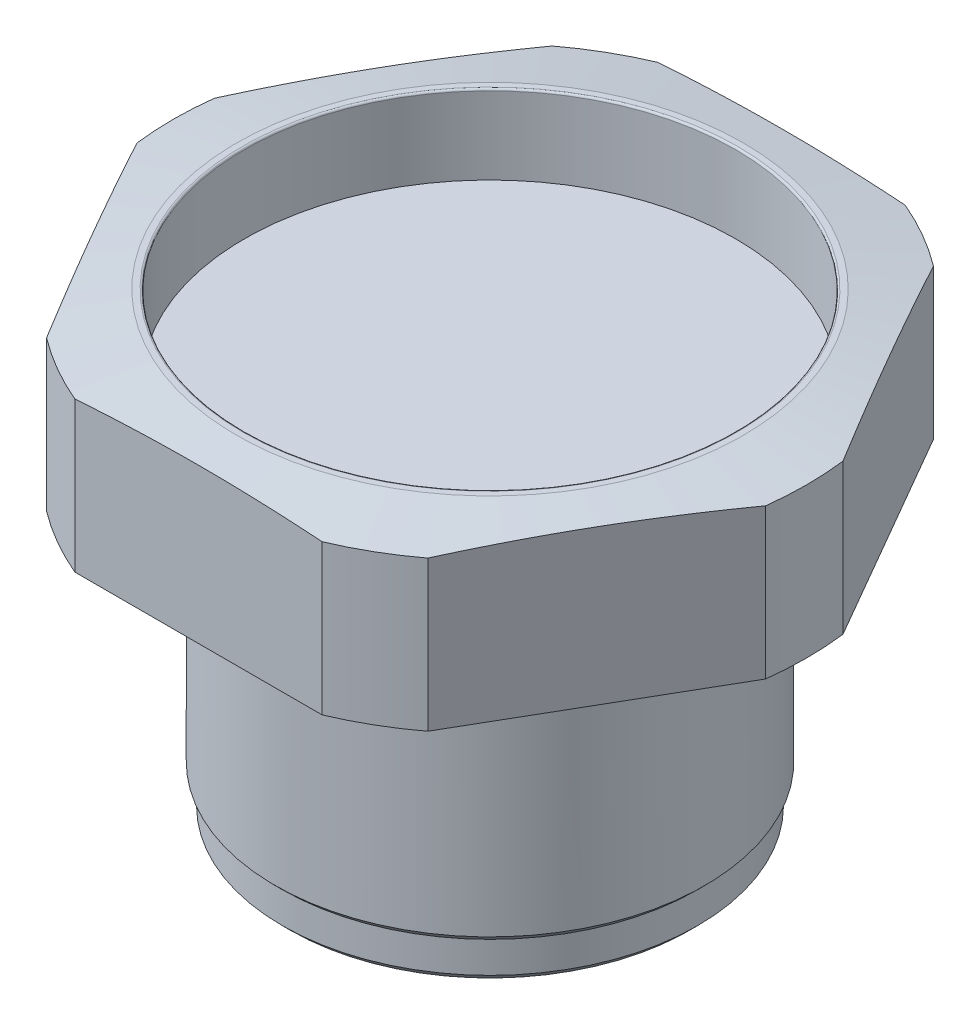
SolidWorks part; units mm, degrees
ref_plane "Front Plane" through (0, 0, 0) normal (0, 0, 1) x (1, 0, 0)
ref_plane "Top Plane" through (0, 0, 0) normal (0, 1, 0) x (1, 0, 0)
ref_plane "Right Plane" through (0, 0, 0) normal (1, 0, 0) x (0, 0, -1)
sketch "Sketch6" plane through (0, 0, 0) normal (0, 0, 1) x (1, 0, 0)
  line L0 (0, -8.9689) -> (0, 71.3762) construction
  line L1 (32.004, 21.0058) -> (33.02, 21.0058)
  line L2 (33.02, 21.0058) -> (41.275, 19.5502)
  line L3 (41.275, 19.5502) -> (41.275, 0)
  line L4 (41.275, 0) -> (27.05, 0)
  line L5 (27.05, 0) -> (27.05, -38.354)
  line L6 (27.05, -38.354) -> (0, -38.354)
  line L7 (0, -38.354) -> (0, 10.6959)
  line L8 (32.004, 21.0058) -> (32.004, 10.6959)
  line L9 (32.004, 10.6959) -> (0, 10.6959)
  dimension "D1" = 54.1
  dimension "D2" = 21.0058
  dimension "D3" = 38.354
  dimension "D4" = 82.55
  dimension "D5" = 10
  dimension "D6" = 66.04
  dimension "D7" = 10.3099
  dimension "D8" = 64.008
  dimension "D9" = 59.3598
revolve "Revolve3" add sketch "Sketch6" angle 360 about L0
fillet "Fillet7" radius 0.25 1 edges at (0, 21.0058, -32.004)
sketch "Sketch7" plane through (0, 0, 0) normal (0, -1, 0) x (1, 0, 0)
  line L0 (0, 0) -> (0, -52.3237) construction
  line L1 (-21.9384, 37.9984) -> (21.9384, 37.9984)
  line L2 (21.9384, 37.9984) -> (43.8768, 0)
  line L3 (43.8768, 0) -> (21.9384, -37.9984)
  line L4 (21.9384, -37.9984) -> (-21.9384, -37.9984)
  line L5 (-21.9384, -37.9984) -> (-43.8768, 0)
  line L6 (-43.8768, 0) -> (-21.9384, 37.9984)
  circle A0 centre (0, 0) radius 43.8768 construction
  dimension "D1" = 75.9968
extrude "Cut-Extrude5" cut sketch "Sketch7" against normal through all flip side to cut
chamfer "Chamfer2" distance 1.016 angle 45 1 edges at (0, -38.354, -27.05)
sketch "Sketch8" plane through (0, 0, 0) normal (0, 0, 1) x (1, 0, 0)
  line L0 (-27.05, -5.08) -> (-27.05, -33.274)
  line L1 (-27.05, 0) -> (-27.05, -37.338) construction
  line L2 (-27.05, -33.274) -> (-28, -32.324)
  line L3 (-28, -32.324) -> (-28, -6.03)
  line L4 (-28, -6.03) -> (-27.05, -5.08)
  line L5 (0, 0) -> (0, -37.338) construction
  line L6 (-27.05, -37.338) -> (27.05, -37.338) construction
  line L7 (-26.034, -38.354) -> (26.034, -38.354) construction
  line L9 (-24.8492, 0) -> (-40.9659, 0) construction
  dimension "D1" = 45
  dimension "D2" = 56
  dimension "D3" = 5.08
  dimension "D4" = 5.08
revolve "Revolve4" add sketch "Sketch8" angle 360 about L5
fillet "Fillet8" radius 0.508 1 edges at (0, 0, -27.05)
sketch "Sketch9" plane through (0, 0, 0) normal (0, 0, 1) x (1, 0, 0)
  line L0 (0, 0) -> (0, -38.354) construction
  line L1 (-26.034, -38.354) -> (26.034, -38.354) construction
  line L2 (0, -38.354) -> (0, -36.9824)
  line L3 (0, -36.9824) -> (11.2649, -36.9824)
  line L4 (11.2649, -36.9824) -> (11.2649, -38.354)
  line L5 (11.2649, -38.354) -> (0, -38.354)
  line L6 (12.573, -38.354) -> (12.573, -37.8714)
  line L7 (12.7154, -38.354) -> (12.573, -38.354)
  line L8 (14.351, -37.8714) -> (14.351, -38.354)
  line L9 (14.351, -38.354) -> (14.2086, -38.354)
  line L10 (17.2466, -36.9824) -> (22.9743, -36.9824)
  line L12 (22.2277, -38.354) -> (15.875, -38.354)
  arc A0 (17.2466, -36.9824) -> (15.875, -38.354) centre (17.2466, -38.354) ccw
  arc A1 (22.9743, -36.9824) -> (22.2277, -38.354) centre (22.9743, -37.8714) ccw
  arc A2 (12.573, -37.8714) -> (12.7154, -38.354) centre (13.462, -37.8714) ccw
  arc A3 (14.2086, -38.354) -> (14.351, -37.8714) centre (13.462, -37.8714) ccw
  point P14 (17.2466, -36.9824)
  dimension "D2" = 1.778
  dimension "D1" = 0.4826
  dimension "D3" = 45.9486
  dimension "D4" = 31.75
  dimension "D5" = 22.5298
  dimension "D6" = 26.924
revolve "Cut-Revolve1" cut sketch "Sketch9" angle 360 about L0
sketch "Sketch10" plane through (0, 0, 0) normal (0, 0, 1) x (1, 0, 0)
  line L0 (-23.857, -37.7656) -> (-22.0916, -37.7657)
  line L2 (-14.3448, -37.7662) -> (-12.5792, -37.7663)
  line L3 (0, 0) -> (0, -34.798) construction
  arc A0 (-22.2277, -38.354) -> (-22.9743, -36.9824) centre (-22.9743, -37.8714) ccw construction
  arc A1 (-23.857, -37.7656) -> (-22.0916, -37.7657) centre (-22.9743, -37.8714) ccw
  arc A2 (-14.351, -37.8714) -> (-14.2086, -38.354) centre (-13.462, -37.8714) ccw construction
  arc A5 (-14.3448, -37.7662) -> (-12.5792, -37.7663) centre (-13.462, -37.8714) ccw
revolve "Revolve6" add sketch "Sketch10" angle 360 about L3
fillet "Fillet9" radius 0.127 2 edges at (-12.573, -37.8714, 0) (-14.351, -38.354, 0)
